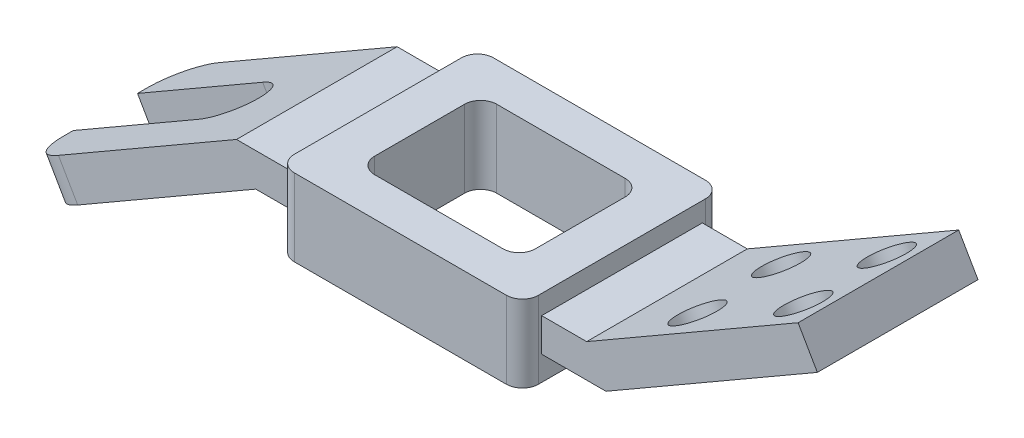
SolidWorks part; units mm, degrees
ref_plane "Front Plane" through (0, 0, 0) normal (0, 0, 1) x (1, 0, 0)
ref_plane "Top Plane" through (0, 0, 0) normal (0, 1, 0) x (1, 0, 0)
ref_plane "Right Plane" through (0, 0, 0) normal (1, 0, 0) x (0, 0, -1)
sketch "Sketch1" plane through (0, 0, 0) normal (0, 0, 1) x (1, 0, 0)
  line L0 (-38, 0) -> (38, 0)
  line L1 (38, 0) -> (52, 0)
  line L2 (52, 0) -> (117.8179, 38)
  line L3 (117.8179, 38) -> (123.8179, 27.6077)
  line L4 (123.8179, 27.6077) -> (58, -10.3923)
  line L5 (58, -10.3923) -> (38, -10.3923)
  line L6 (38, -10.3923) -> (-38, -10.3923)
  line L7 (-38, -10.3923) -> (-51, -10.3923)
  line L8 (-51, -10.3923) -> (-116.8179, -48.3923)
  line L9 (-116.8179, -48.3923) -> (-122.8179, -38)
  line L10 (-122.8179, -38) -> (-57, 0)
  line L11 (-57, 0) -> (-38, 0)
  line L12 (-57, 0) -> (-65.8804, 0) construction
  line L13 (58, -10.3923) -> (65.5856, -10.3923) construction
  point P3 (121.7716, 38)
  point P4 (0, 0)
  point P15 (0, 0)
  dimension "D1" = 76
  dimension "D2" = 19
  dimension "D3" = 30
  dimension "D4" = 76
  dimension "D5" = 12
  dimension "D6" = 20
  dimension "D7" = 12
  dimension "D8" = 76
extrude "Boss-Extrude1" add sketch "Sketch1" along normal blind 50
sketch "Sketch2" plane through (0, 0, 0) normal (0, 1, 0) x (1, 0, 0)
  line L0 (-57, -50) -> (-57, 0) construction
  line L1 (-38, 6) -> (38, 6)
  line L2 (-38, 6) -> (-38, -56)
  line L3 (-38, -56) -> (38, -56)
  line L4 (38, 6) -> (38, -56)
  point P6 (-57, -25)
  point P7 (-38, -25)
  dimension "D1" = 76
  dimension "D2" = 62
  dimension "D3" = 19
extrude "Boss-Extrude2" add sketch "Sketch2" along normal blind 6 and the other way blind 18
sketch "Sketch3" plane through (0, 6, 0) normal (0, 1, 0) x (1, 0, 0)
  line L0 (-38, -56) -> (38, -56) construction
  line L1 (-25, -6) -> (25, -6)
  line L2 (-25, -6) -> (-25, -44)
  line L3 (-25, -44) -> (25, -44)
  line L4 (25, -6) -> (25, -44)
  line L5 (38, -56) -> (38, 6) construction
  dimension "D1" = 50
  dimension "D2" = 38
  dimension "D3" = 12
  dimension "D4" = 13
extrude "Cut-Extrude1" cut sketch "Sketch3" against normal through all
sketch "Sketch4" plane through (-14.25, 24.6817, 0) normal (-0.5, 0.866, 0) x (0.866, 0.5, 0)
  line L0 (-125.3634, -25) -> (-80.3634, -25) construction
  line L1 (-125.3634, -50) -> (-125.3634, 0) construction
  line L2 (-80.3634, -15) -> (-125.3634, -15)
  line L3 (-80.3634, -35) -> (-125.3634, -35)
  line L4 (-125.3634, -35) -> (-125.3634, -15)
  arc A0 (-80.3634, -35) -> (-80.3634, -15) centre (-80.3634, -25) ccw
  dimension "D1" = 20
  dimension "D2" = 45
extrude "Cut-Extrude2" cut sketch "Sketch4" against normal through all
sketch "Sketch5" plane through (13, -22.5167, 0) normal (-0.5, 0.866, 0) x (0.866, 0.5, 0)
  line L0 (121.0333, 0) -> (45.0333, 0) construction
  line L1 (121.0333, -50) -> (121.0333, 0) construction
  circle A0 centre (109.0333, -12) radius 7
  circle A1 centre (71.0333, -12) radius 7
  circle A2 centre (71.0333, -38) radius 7
  circle A3 centre (109.0333, -38) radius 7
  point P7 (0, 0)
  point P8 (0, 0)
  point P14 (0, 0)
  dimension "D1" = 14
  dimension "D2" = 12
  dimension "D3" = 12
  dimension "D6" = 38
  dimension "D7" = 26
  dimension "D4" = 2
  dimension "D5" = 2
extrude "Cut-Extrude3" cut sketch "Sketch5" against normal through all
fillet "Fillet1" radius 12 2 edges at (-119.8179, -43.1962, 0) (-119.8179, -43.1962, 50)
fillet "Fillet2" radius 5 8 edges at (-25, -6, 6) (-25, -6, 44) (25, -6, 6) (25, -6, 44) (38, -6, -6) (-38, -6, -6) (38, -6, 56) (-38, -6, 56)
